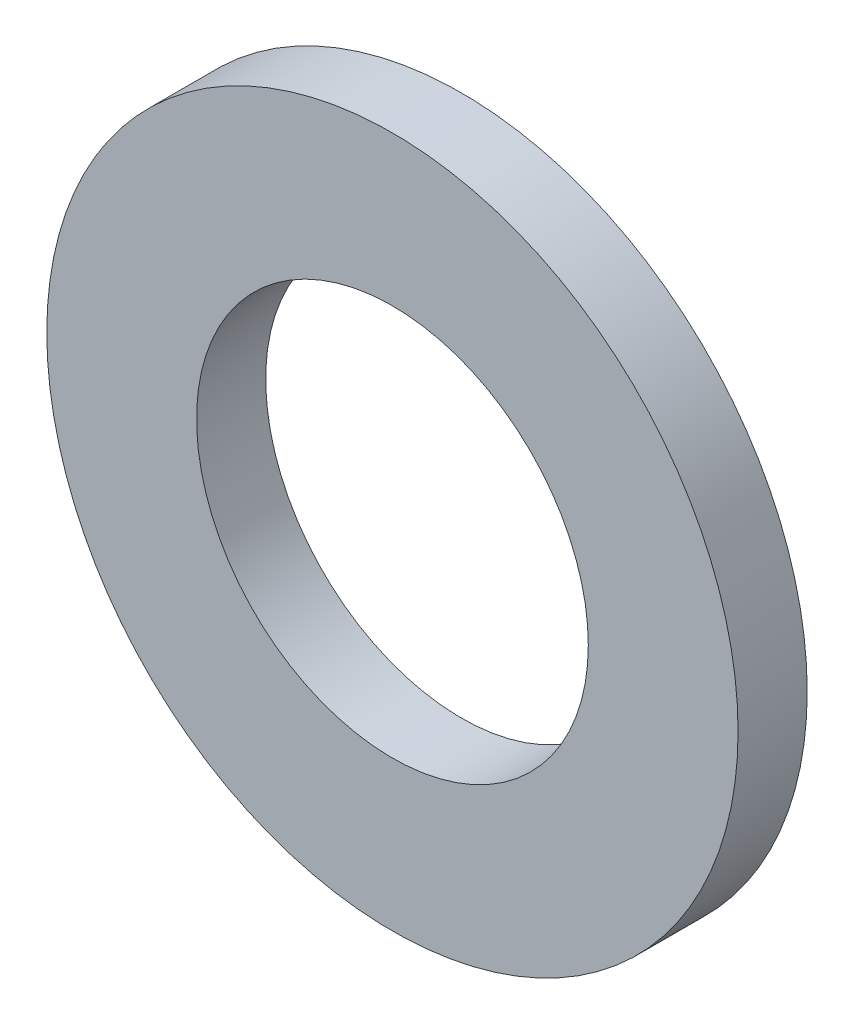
SolidWorks part; units mm, degrees
ref_plane "Face" through (0, 0, 0) normal (0, 0, 1) x (1, 0, 0)
ref_plane "Dessus" through (0, 0, 0) normal (0, 1, 0) x (1, 0, 0)
ref_plane "Droite" through (0, 0, 0) normal (1, 0, 0) x (0, 0, -1)
sketch "Esquisse1" plane through (0, 0, 0) normal (0, 0, 1) x (1, 0, 0)
  circle A0 centre (0, 0) radius 15
  circle A1 centre (0, 0) radius 8.5
  dimension "D1" = 17
  dimension "D2" = 30
extrude "Extrusion1" add sketch "Esquisse1" along normal blind 3
